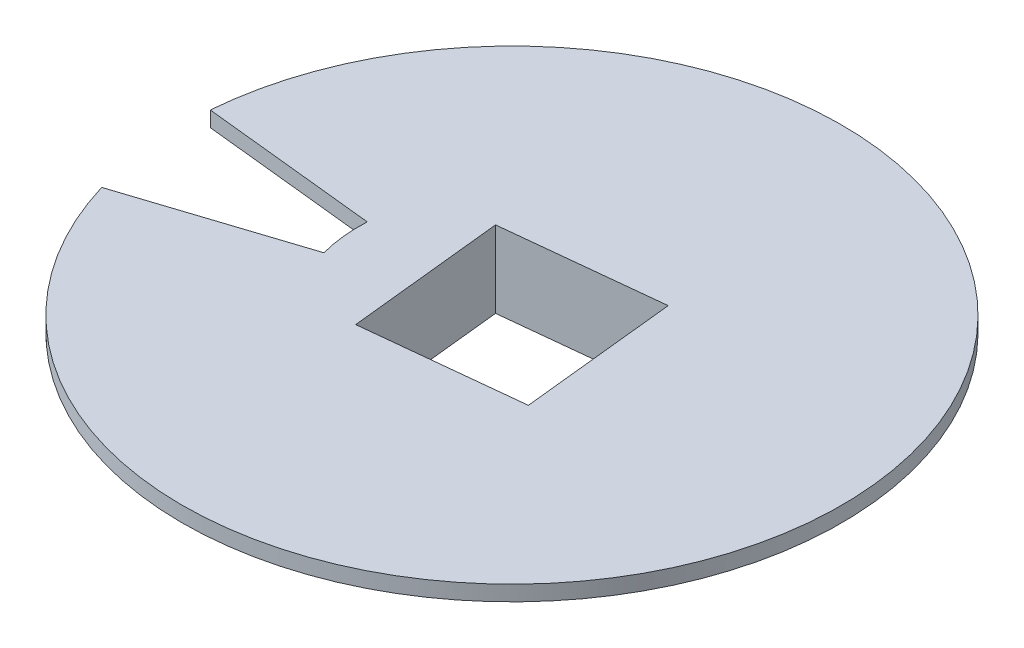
SolidWorks part; units mm, degrees
ref_plane "Front Plane" through (0, 0, 0) normal (0, 0, 1) x (1, 0, 0)
ref_plane "Top Plane" through (0, 0, 0) normal (0, 1, 0) x (1, 0, 0)
ref_plane "Right Plane" through (0, 0, 0) normal (1, 0, 0) x (0, 0, -1)
sketch "Sketch1" plane through (0, 0, 0) normal (0, 1, 0) x (1, 0, 0)
  line L0 (-1.8271, 0.8135) -> (1.8271, -0.8135)
  line L1 (-2, 0) -> (2, 0)
  line L2 (-2, 0) -> (-2, -89.9778)
  line L3 (-2, -89.9778) -> (2, -89.9778)
  line L4 (2, 0) -> (2, -89.9778)
  line L5 (-1.8271, 0.8135) -> (-38.4243, -81.3853)
  line L6 (-38.4243, -81.3853) -> (-34.7702, -83.0123)
  line L7 (1.8271, -0.8135) -> (-34.7702, -83.0123)
  line L8 (-1.3383, 1.4863) -> (1.3383, -1.4863)
  line L9 (-1.3383, 1.4863) -> (-68.2048, -58.7206)
  line L10 (-68.2048, -58.7206) -> (-65.5283, -61.6932)
  line L11 (1.3383, -1.4863) -> (-65.5283, -61.6932)
  line L12 (-0.618, 1.9021) -> (0.618, -1.9021)
  line L13 (-0.618, 1.9021) -> (-86.192, -25.9025)
  line L14 (-86.192, -25.9025) -> (-84.9559, -29.7068)
  line L15 (0.618, -1.9021) -> (-84.9559, -29.7068)
  line L16 (0.2091, 1.989) -> (-0.2091, -1.989)
  line L17 (0.2091, 1.989) -> (-89.2758, 11.3943)
  line L18 (-89.2758, 11.3943) -> (-89.6939, 7.4162)
  line L19 (-0.2091, -1.989) -> (-89.6939, 7.4162)
  line L20 (1, 1.7321) -> (-1, -1.7321)
  line L21 (1, 1.7321) -> (-76.923, 46.7209)
  line L22 (-76.923, 46.7209) -> (-78.923, 43.2568)
  line L23 (-1, -1.7321) -> (-78.923, 43.2568)
  line L24 (1.618, 1.1756) -> (-1.618, -1.1756)
  line L25 (1.618, 1.1756) -> (-51.2696, 73.9691)
  line L26 (-51.2696, 73.9691) -> (-54.5056, 71.618)
  line L27 (-1.618, -1.1756) -> (-54.5056, 71.618)
  line L28 (1.9563, 0.4158) -> (-1.9563, -0.4158)
  line L29 (1.9563, 0.4158) -> (-16.7511, 88.4274)
  line L30 (-16.7511, 88.4274) -> (-20.6637, 87.5957)
  line L31 (-1.9563, -0.4158) -> (-20.6637, 87.5957)
  line L32 (1.9563, -0.4158) -> (-1.9563, 0.4158)
  line L33 (1.9563, -0.4158) -> (20.6637, 87.5957)
  line L34 (20.6637, 87.5957) -> (16.7511, 88.4274)
  line L35 (-1.9563, 0.4158) -> (16.7511, 88.4274)
  line L36 (1.618, -1.1756) -> (-1.618, 1.1756)
  line L37 (1.618, -1.1756) -> (54.5056, 71.618)
  line L38 (54.5056, 71.618) -> (51.2696, 73.9691)
  line L39 (-1.618, 1.1756) -> (51.2696, 73.9691)
  line L40 (1, -1.7321) -> (-1, 1.7321)
  line L41 (1, -1.7321) -> (78.923, 43.2568)
  line L42 (78.923, 43.2568) -> (76.923, 46.7209)
  line L43 (-1, 1.7321) -> (76.923, 46.7209)
  line L44 (0.2091, -1.989) -> (-0.2091, 1.989)
  line L45 (0.2091, -1.989) -> (89.6939, 7.4162)
  line L46 (89.6939, 7.4162) -> (89.2758, 11.3943)
  line L47 (-0.2091, 1.989) -> (89.2758, 11.3943)
  line L48 (-0.618, -1.9021) -> (0.618, 1.9021)
  line L49 (-0.618, -1.9021) -> (84.9559, -29.7068)
  line L50 (84.9559, -29.7068) -> (86.192, -25.9025)
  line L51 (0.618, 1.9021) -> (86.192, -25.9025)
  line L52 (-1.3383, -1.4863) -> (1.3383, 1.4863)
  line L53 (-1.3383, -1.4863) -> (65.5283, -61.6932)
  line L54 (65.5283, -61.6932) -> (68.2048, -58.7206)
  line L55 (1.3383, 1.4863) -> (68.2048, -58.7206)
  line L56 (-1.8271, -0.8135) -> (1.8271, 0.8135)
  line L57 (-1.8271, -0.8135) -> (34.7702, -83.0123)
  line L58 (34.7702, -83.0123) -> (38.4243, -81.3853)
  line L59 (1.8271, 0.8135) -> (38.4243, -81.3853)
  circle A1 centre (0, 0) radius 90
  point P7 (0, 0)
  point P126 (0, 0)
  dimension "D1" = 180
  dimension "D2" = 4
  dimension "D3" = 15
sketch "Sketch7" plane through (0, 0, 0) normal (0, 0, 1) x (1, 0, 0)
  line L6 (0, 0) -> (-86, 0)
  line L7 (0, 0) -> (0, -4)
  line L8 (0, -4) -> (-86, -4)
  line L9 (-86, 0) -> (-86, -4)
  dimension "D1" = 4
  dimension "D2" = 86
revolve "Revolve4" add sketch "Sketch7" angle 360 about L7
sketch "Sketch9" plane through (0, 0, 0) normal (0, 1, 0) x (1, 0, 0)
  circle A0 centre (0, 0) radius 40
  dimension "D1" = 80
extrude "Cut-Extrude3" cut sketch "Sketch9" against normal through all and the other way through all
extrude "Cut-Extrude4" cut sketch "Sketch1" against normal through all contours L19 A1 L13
ref_plane "Plane1" through (0, 0, 0) normal (0, -1, 0) x (-1, 0, 0)
sketch "Sketch10" plane through (0, 0, 0) normal (0, -1, 0) x (-1, 0, 0)
  circle A0 centre (0, 0) radius 40
extrude "Boss-Extrude1" add sketch "Sketch10" along normal blind 20
sketch "Sketch14" plane through (0, 0, 0) normal (0, 1, 0) x (1, 0, 0)
  line L0 (-39.7809, -4.1811) -> (0, 0) construction
  line L1 (18.2449, 22.5305) -> (-22.5305, 18.2449)
  line L2 (-22.5305, 18.2449) -> (-18.2449, -22.5305)
  line L3 (-18.2449, -22.5305) -> (22.5305, -18.2449)
  line L4 (22.5305, -18.2449) -> (18.2449, 22.5305)
  arc A1 (-39.9402, 2.1869) -> (-38.6127, -10.4431) centre (0, 0) ccw construction
  arc A10 (-39.9402, 2.1869) -> (-38.6127, -10.4431) centre (0, 0) ccw construction
  dimension "D3" = 20.5
  dimension "D1" = 41
  dimension "D2" = 20.5
extrude "Cut-Extrude7" cut sketch "Sketch14" against normal through all
